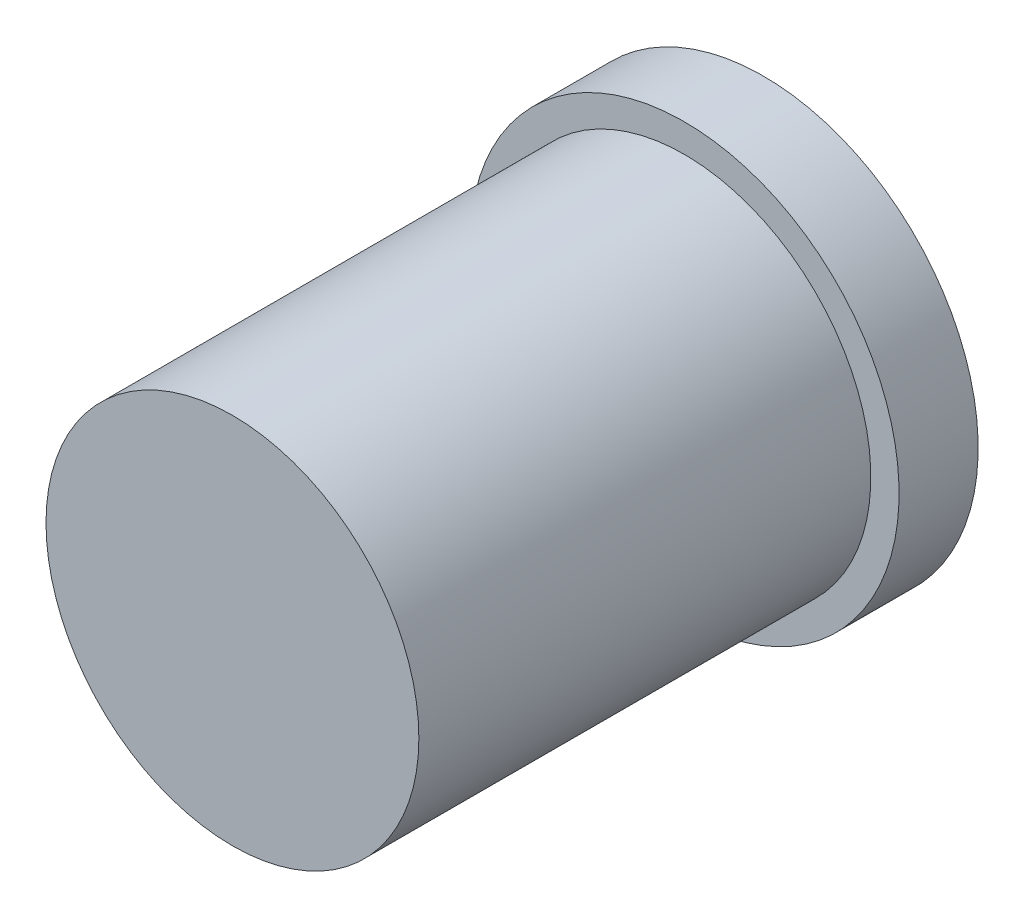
SolidWorks part; units mm, degrees
ref_plane "Face" through (0, 0, 0) normal (0, 0, 1) x (1, 0, 0)
ref_plane "Dessus" through (0, 0, 0) normal (0, 1, 0) x (1, 0, 0)
ref_plane "Droite" through (0, 0, 0) normal (1, 0, 0) x (0, 0, -1)
sketch "Esquisse1" plane through (0, 0, 0) normal (0, 0, 1) x (1, 0, 0)
  circle A0 centre (0, 0) radius 8.25
  dimension "D1" = 16.5
extrude "Extrusion1" add sketch "Esquisse1" along normal blind 20
sketch "Esquisse2" plane through (0, 0, 0) normal (0, 0, -1) x (-1, 0, 0)
  circle A0 centre (0, 0) radius 9.5
  dimension "D1" = 19
extrude "Extrusion2" add sketch "Esquisse2" along normal blind 3.5
sketch "Esquisse3" plane through (0, 0, -3.5) normal (0, 0, -1) x (-1, 0, 0)
  line L0 (-5, -1.5) -> (-5, -3.5)
  line L1 (-4.5, 4) -> (4.5, 4)
  line L2 (-5, 3.5) -> (-5, 1.5)
  line L3 (-4.5, -4) -> (4.5, -4)
  line L4 (5, 3.5) -> (5, 1.5)
  line L5 (-6.8374, 0.5) -> (-6, 0.5)
  line L6 (5, -1.5) -> (5, -3.5)
  line L7 (-6.8374, -0.5) -> (-6, -0.5)
  line L8 (6, 0.5) -> (6.8374, 0.5)
  line L9 (6, -0.5) -> (6.8374, -0.5)
  arc A0 (7.8142, 1.7143) -> (-7.8142, 1.7143) centre (0, 0) ccw
  arc A1 (-7.8142, -1.7143) -> (7.8142, -1.7143) centre (0, 0) ccw
  arc A2 (-4.5, 4) -> (-5, 3.5) centre (-4.5, 3.5) ccw
  arc A3 (5, 3.5) -> (4.5, 4) centre (4.5, 3.5) ccw
  arc A4 (4.5, -4) -> (5, -3.5) centre (4.5, -3.5) ccw
  arc A5 (-4.5, -4) -> (-5, -3.5) centre (-4.5, -3.5) cw
  arc A6 (-6.8374, 0.5) -> (-7.8142, 1.7143) centre (-6.8374, 1.5) cw
  arc A7 (-5, 1.5) -> (-6, 0.5) centre (-6, 1.5) cw
  arc A8 (-5, -1.5) -> (-6, -0.5) centre (-6, -1.5) ccw
  arc A9 (-7.8142, -1.7143) -> (-6.8374, -0.5) centre (-6.8374, -1.5) cw
  arc A10 (5, -1.5) -> (6, -0.5) centre (6, -1.5) cw
  arc A11 (6, 0.5) -> (5, 1.5) centre (6, 1.5) cw
  arc A12 (6.8374, 0.5) -> (7.8142, 1.7143) centre (6.8374, 1.5) ccw
  arc A13 (7.8142, -1.7143) -> (6.8374, -0.5) centre (6.8374, -1.5) ccw
extrude "Extrusion3" add sketch "Esquisse3" along normal blind 1
